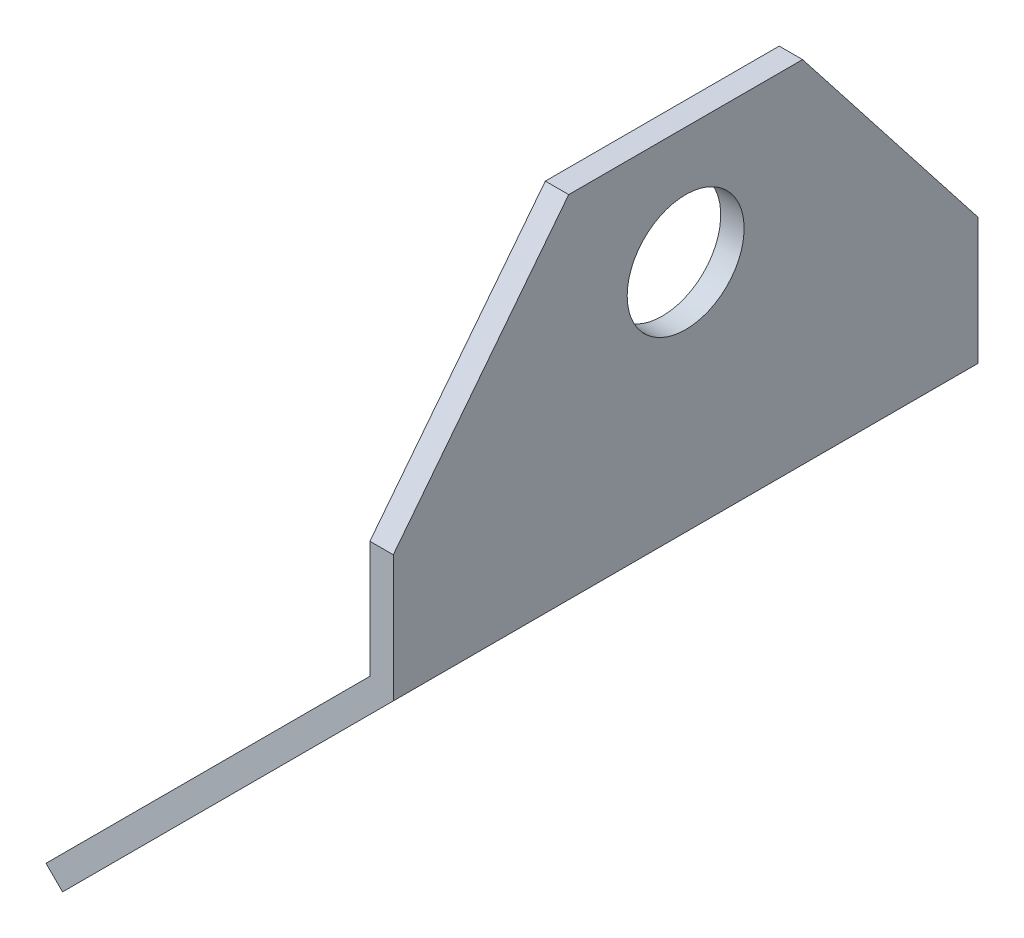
SolidWorks part; units mm, degrees
ref_plane "Piano frontale" through (0, 0, 0) normal (0, 0, 1) x (1, 0, 0)
ref_plane "Piano superiore" through (0, 0, 0) normal (0, 1, 0) x (1, 0, 0)
ref_plane "Piano destro" through (0, 0, 0) normal (1, 0, 0) x (0, 0, -1)
sketch "Schizzo2" plane through (0, 0, 0) normal (0, 0, 1) x (1, 0, 0)
  line L0 (0, 0) -> (0, 30)
  line L1 (0, 0) -> (-28.2843, -28.2843)
  dimension "D1" = 30
  dimension "D2" = 40
  dimension "D3" = 45
extrude "Estrusione-Sottile1" add sketch "Schizzo2" along normal blind 50 thin
sketch "Schizzo3" plane through (-2, 0, 0) normal (-1, 0, 0) x (0, 0, 1)
  line L6 (25, 0.8284) -> (25, 40.4241) construction
  line L9 (-13.0885, 19.6008) -> (-12.3191, 49.1105)
  line L10 (-12.3191, 49.1105) -> (50.003, 49.1105)
  line L11 (50.003, 49.1105) -> (54.1416, 10.4719)
  line L14 (50, 0.8284) -> (0, 0.8284) construction
  line L15 (35, 30) -> (15, 30)
  line L16 (50, 30) -> (0, 30) construction
  line L17 (15, 30) -> (0, 10.8284)
  line L18 (0, 30) -> (0, 0.8284) construction
  line L19 (35, 30) -> (50, 10.8284)
  line L20 (50, 10.8284) -> (54.1416, 10.4719)
  line L21 (0, 10.8284) -> (-13.0885, 19.6008)
  point P14 (25, 30)
  dimension "D1" = 10
  dimension "D2" = 10
extrude "Taglio-Estrusione1" cut sketch "Schizzo3" against normal up to next contours L10 L11 L20 L19 L15 L17 L21 L9
hole_wizard "Foro Ø10.0 (10)-1" positions "Schizzo3D1" profile "Schizzo5" hole size "Ø10.0" standard "ISO"
sketch3d "Schizzo3D1"
  line L0 (-2, 30, 35) -> (-2, 30, 15) construction
  line L1 (-2, 30, 25) -> (-2, 11.7176, 25) construction
  point P0 (-2, 20, 25)
  dimension "D1" = 10
sketch "Schizzo5" plane through (-2, 20, 25) normal (0, 1, 0) x (0, 0, 1)
  line L0 (0, 0) -> (0, 2)
  line L1 (0, 2) -> (5, 2)
  line L2 (5, 2) -> (5, 0)
  line L5 (5, 0) -> (0, 0)
  line L11 (0, -6.35) -> (0, 107.95) construction
  dimension "Thru Hole Dia." = 10
  dimension "Thru Hole Depth" = 2
sketch "Schizzo6" plane through (-1.4142, 1.4142, 0) normal (-0.7071, 0.7071, 0) x (0, 0, 1)
  line L0 (25, -40) -> (25, -1.9544) construction
  line L1 (50, -40) -> (0, -40) construction
  circle A0 centre (12.54, -20) radius 4
  circle A1 centre (37.46, -20) radius 4
  dimension "D1" = 8
  dimension "D2" = 8
  dimension "D3" = 24.92
  dimension "D4" = 20
extrude "Taglio-Estrusione2" cut sketch "Schizzo6" against normal up to next
